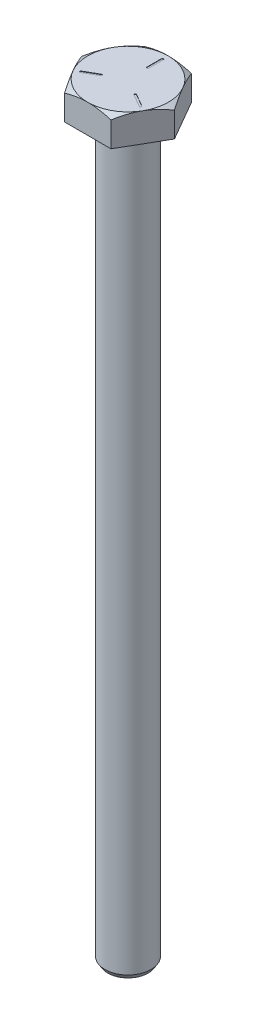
SolidWorks part; units mm, degrees
ref_plane "Front Plane" through (0, 0, 0) normal (0, 0, 1) x (1, 0, 0)
ref_plane "Top Plane" through (0, 0, 0) normal (0, 1, 0) x (1, 0, 0)
ref_plane "Right Plane" through (0, 0, 0) normal (1, 0, 0) x (0, 0, -1)
sketch "Sketch1" plane through (0, 0, 0) normal (0, 1, 0) x (1, 0, 0)
  line L1 (6.4158, 0) -> (3.2079, 5.5562)
  line L2 (3.2079, 5.5562) -> (-3.2079, 5.5562)
  line L3 (-3.2079, 5.5562) -> (-6.4158, 0)
  line L4 (-6.4158, 0) -> (-3.2079, -5.5563)
  line L5 (-3.2079, -5.5563) -> (3.2079, -5.5562)
  line L6 (3.2079, -5.5562) -> (6.4158, 0)
  circle A0 centre (0, 0) radius 5.5562 construction
  dimension "D1" = 11.1125
extrude "Boss-Extrude1" add sketch "Sketch1" along normal blind 3.9624
sketch "Sketch2" plane through (0, 0, 0) normal (0, 0, 1) x (1, 0, 0)
  line L0 (5.5563, 3.9624) -> (6.4158, 3.4544)
  line L2 (6.4158, 3.9624) -> (6.4158, 0) construction
  line L3 (6.4158, 3.4544) -> (6.4158, 3.9624)
  line L4 (6.4158, 3.9624) -> (5.5563, 3.9624)
  line L5 (0, 0) -> (0, 3.9624) construction
  line L6 (-3.2079, 0) -> (3.2079, 0) construction
  line L7 (-3.2079, 3.9624) -> (3.2079, 3.9624) construction
  line L8 (6.4158, 3.9624) -> (6.4158, 0) construction
  line L9 (3.2079, 3.9624) -> (6.4158, 3.9624) construction
  dimension "D1" = 5.5562
  dimension "D2" = 0.508
revolve "Cut-Revolve1" cut sketch "Sketch2" angle 360 about L5
sketch "Sketch3" plane through (0, 3.9624, 0) normal (0, -1, 0) x (-1, 0, 0)
  line L0 (0, 4.7625) -> (0, 2.7305) construction
  line L1 (0.127, 4.7625) -> (0.127, 2.7305)
  line L2 (-0.127, 4.7625) -> (-0.127, 2.7305)
  line L3 (4.1244, -2.3812) -> (2.3647, -1.3652) construction
  line L4 (4.0609, -2.4912) -> (2.3012, -1.4752)
  line L5 (4.1879, -2.2713) -> (2.4282, -1.2553)
  line L6 (-4.1244, -2.3812) -> (-2.3647, -1.3652) construction
  line L7 (-4.1879, -2.2713) -> (-2.4282, -1.2553)
  line L8 (-4.0609, -2.4912) -> (-2.3012, -1.4752)
  arc A0 (0.127, 4.7625) -> (-0.127, 4.7625) centre (0, 4.7625) ccw
  arc A1 (-0.127, 2.7305) -> (0.127, 2.7305) centre (0, 2.7305) ccw
  arc A2 (4.0609, -2.4912) -> (4.1879, -2.2713) centre (4.1244, -2.3812) ccw
  arc A3 (2.4282, -1.2553) -> (2.3012, -1.4752) centre (2.3647, -1.3652) ccw
  arc A4 (-4.1879, -2.2713) -> (-4.0609, -2.4912) centre (-4.1244, -2.3812) ccw
  arc A5 (-2.3012, -1.4752) -> (-2.4282, -1.2553) centre (-2.3647, -1.3652) ccw
  point P3 (0, 3.7465)
  point P12 (3.2446, -1.8732)
  point P19 (-3.2446, -1.8732)
  point P24 (0, 0)
  dimension "D1" = 0.127
  dimension "D2" = 2.032
  dimension "D3" = 4.7625
  dimension "D4" = 3
extrude "Cut-Extrude1" cut sketch "Sketch3" along normal blind 0.0508
sketch "Sketch6" plane through (0, 0, 0) normal (0, 0, 1) x (1, 0, 0)
  line L0 (0, 0) -> (0, 3.302)
  line L1 (0, 3.302) -> (2.7381, 3.302)
  line L3 (3.2079, 3.9624) -> (6.4158, 3.9624) construction
  line L5 (5.4445, 0) -> (5.526, 0.4016)
  line L8 (6.4158, 0) -> (5.4445, 0)
  line L9 (-3.2079, 0) -> (3.2079, 0) construction
  line L10 (0, 3.302) -> (0, 3.9624)
  line L11 (0, 3.9624) -> (5.5563, 3.9624)
  line L12 (5.5562, 3.9624) -> (4.8119, 3.9624) construction
  line L13 (5.5563, 3.9624) -> (6.4158, 3.4544)
  line L14 (6.4158, 3.4544) -> (6.4158, 0)
  line L15 (0, 3.9624) -> (0, 3.302)
  arc A0 (2.8154, 3.2831) -> (5.5127, 0.508) centre (-0.014, -2.1652) cw
  arc A1 (2.7381, 3.302) -> (2.8154, 3.2831) centre (2.7381, 3.1344) cw
  arc A2 (5.526, 0.4016) -> (5.5127, 0.508) centre (5.3617, 0.435) ccw
  point P13 (2.7788, 3.302)
  point P16 (5.5372, 0.4566)
  dimension "D6" = 6.1392
  dimension "D7" = 0.1676
  dimension "D1" = 0.508
  dimension "D2" = 2.7788
  dimension "D3" = 101.48
  dimension "D4" = 5.5372
  dimension "D5" = 3.302
revolve "Cut-Revolve2" [suppressed] cut sketch "Sketch6" angle 360 about L0
sketch "Sketch7" [suppressed] plane through (0, 2.5654, 0) normal (0, 1, 0) x (1, 0, 0)
  line L1 (1.8331, 0) -> (0.9165, 1.5875)
  line L2 (0.9165, 1.5875) -> (-0.9165, 1.5875)
  line L3 (-0.9165, 1.5875) -> (-1.8331, 0)
  line L4 (-1.8331, 0) -> (-0.9165, -1.5875)
  line L5 (-0.9165, -1.5875) -> (0.9165, -1.5875)
  line L6 (0.9165, -1.5875) -> (1.8331, 0)
  circle A0 centre (0, 0) radius 1.5875 construction
  dimension "D1" = 3.9688
extrude "Cut-Extrude2" [suppressed] cut sketch "Sketch7" against normal blind 1.524
sketch "Sketch8" [suppressed] plane through (0, 0, 0) normal (0, 0, 1) x (1, 0, 0)
  line L0 (-1.8331, 2.5654) -> (-1.5283, 2.3876)
  line L1 (-1.5283, 2.3876) -> (-1.5283, 2.5654)
  line L2 (-1.5283, 2.5654) -> (-1.8331, 2.5654)
  line L3 (0, 0) -> (0, -30.4461) construction
  line L4 (-1.5283, 2.3876) -> (0, 2.3876)
  line L5 (0, 2.3876) -> (0, 2.5654)
  line L6 (0, 2.5654) -> (-1.5283, 2.5654)
  dimension "D1" = 0.1778
  dimension "D2" = 0.3048
revolve "Cut-Revolve3" [suppressed] cut sketch "Sketch8" angle 360 about L3
sketch "Sketch9" [suppressed] plane through (0, 3.9624, 0) normal (0, 1, 0) x (-1, 0, 0)
  line L0 (-4.8119, 2.7781) -> (-6.4158, 0) construction
  line L1 (-6.4158, 0) -> (-4.8119, -2.7781) construction
  line L2 (-4.8119, -2.7781) -> (-3.2079, -5.5562) construction
  line L3 (-3.2079, -5.5562) -> (0, -5.5563) construction
  line L4 (3.2079, -5.5562) -> (4.8119, -2.7781) construction
  line L5 (0, -5.5563) -> (3.2079, -5.5562) construction
  line L6 (6.4158, 0) -> (4.8119, 2.7781) construction
  line L7 (4.8119, -2.7781) -> (6.4158, 0) construction
  line L8 (3.2079, 5.5563) -> (0, 5.5563) construction
  line L9 (4.8119, 2.7781) -> (3.2079, 5.5563) construction
  line L10 (0, 5.5563) -> (-3.2079, 5.5562) construction
  line L11 (-3.2079, 5.5562) -> (-4.8119, 2.7781) construction
  line L12 (-4.8119, 2.7781) -> (-6.4158, 0)
  line L13 (-6.4158, 0) -> (-4.8119, -2.7781)
  line L14 (-4.8119, -2.7781) -> (-3.2079, -5.5562)
  line L15 (-3.2079, -5.5562) -> (0, -5.5563)
  line L16 (3.2079, -5.5562) -> (4.8119, -2.7781)
  line L17 (0, -5.5563) -> (3.2079, -5.5562)
  line L18 (6.4158, 0) -> (4.8119, 2.7781)
  line L19 (4.8119, -2.7781) -> (6.4158, 0)
  line L20 (3.2079, 5.5563) -> (0, 5.5563)
  line L21 (4.8119, 2.7781) -> (3.2079, 5.5563)
  line L22 (0, 5.5563) -> (-3.2079, 5.5562)
  line L23 (-3.2079, 5.5562) -> (-4.8119, 2.7781)
  circle A0 centre (0, 0) radius 3.9688
  arc A1 (-4.8119, 2.7781) -> (-4.8119, -2.7781) centre (0, 0) ccw construction
  arc A2 (-4.8119, -2.7781) -> (0, -5.5563) centre (0, 0) ccw construction
  arc A3 (0, -5.5563) -> (4.8119, -2.7781) centre (0, 0) ccw construction
  arc A4 (4.8119, -2.7781) -> (4.8119, 2.7781) centre (0, 0) ccw construction
  arc A5 (4.8119, 2.7781) -> (0, 5.5563) centre (0, 0) ccw construction
  arc A6 (0, 5.5563) -> (-4.8119, 2.7781) centre (0, 0) ccw construction
  arc A7 (-4.8119, 2.7781) -> (-4.8119, -2.7781) centre (0, 0) ccw
  arc A8 (-4.8119, -2.7781) -> (0, -5.5563) centre (0, 0) ccw
  arc A9 (0, -5.5563) -> (4.8119, -2.7781) centre (0, 0) ccw
  arc A10 (4.8119, -2.7781) -> (4.8119, 2.7781) centre (0, 0) ccw
  arc A11 (4.8119, 2.7781) -> (0, 5.5563) centre (0, 0) ccw
  arc A12 (0, 5.5563) -> (-4.8119, 2.7781) centre (0, 0) ccw
  dimension "D1" = 9.525
extrude "Cut-Extrude3" [suppressed] cut sketch "Sketch9" against normal through all
sketch "Sketch11" [suppressed] plane through (0, 3.9624, 0) normal (0, -1, 0) x (-1, 0, 0)
  circle A0 centre (0, 0) radius 3.9688 construction
  circle A1 centre (0, 0) radius 3.9688
extrude "Boss-Extrude3" [suppressed] add sketch "Sketch11" against normal blind 2.3876
sketch "Sketch12" [suppressed] plane through (0, 6.35, 0) normal (0, -1, 0) x (-1, 0, 0)
  line L1 (2.2914, 0) -> (1.1457, 1.9844)
  line L2 (1.1457, 1.9844) -> (-1.1457, 1.9844)
  line L3 (-1.1457, 1.9844) -> (-2.2914, 0)
  line L4 (-2.2914, 0) -> (-1.1457, -1.9844)
  line L5 (-1.1457, -1.9844) -> (1.1457, -1.9844)
  line L6 (1.1457, -1.9844) -> (2.2914, 0)
  circle A0 centre (0, 0) radius 1.9844 construction
  dimension "D1" = 4.7625
extrude "Cut-Extrude4" [suppressed] cut sketch "Sketch12" along normal blind 3.175
fillet "Fillet1" [suppressed] radius 0.3175
sketch "Sketch14" [suppressed] plane through (0, 0, 0) normal (0, 0, 1) x (1, 0, 0)
  line L0 (-2.3454, 5.9531) -> (-3.0328, 6.35)
  line L1 (3.6513, 6.35) -> (-3.6513, 6.35) construction
  line L2 (-3.0328, 6.35) -> (0, 6.35)
  line L3 (0, 6.35) -> (0, 5.9531)
  line L5 (0, 5.9531) -> (-2.3454, 5.9531)
  dimension "D1" = 3.0328
  dimension "D2" = 30
  dimension "D3" = 0.7937
revolve "Cut-Revolve4" [suppressed] cut sketch "Sketch14" angle 360 about L3
sketch "Bolt Length Sketch" plane through (0, 0, 0) normal (0, 0, 1) x (1, 0, 0)
  line L0 (0, 0) -> (0, -101.6)
  line L1 (0, -101.6) -> (2.7781, -101.6)
  line L2 (2.7781, -101.6) -> (3.175, -100.965)
  line L3 (3.175, -100.965) -> (3.175, 0)
  line L6 (0, 0) -> (3.175, 0)
  dimension "D1" = 3.175
  dimension "D2" = 0.635
  dimension "D3" = 0.3969
  dimension "D4" = 101.6
revolve "Bolt Length" add sketch "Bolt Length Sketch" angle 360 about L0
